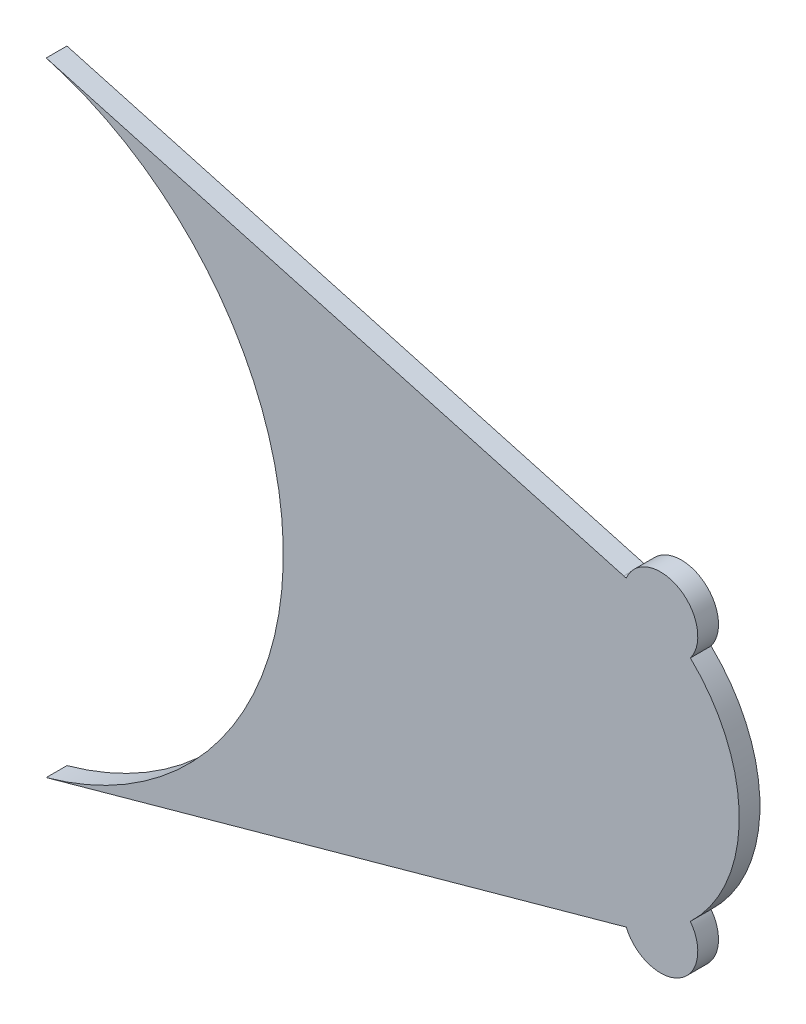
SolidWorks part; units mm, degrees
ref_plane "Plan de face" through (0, 0, 0) normal (0, 0, 1) x (1, 0, 0)
ref_plane "Plan de dessus" through (0, 0, 0) normal (0, 1, 0) x (1, 0, 0)
ref_plane "Plan de droite" through (0, 0, 0) normal (1, 0, 0) x (0, 0, -1)
sketch "Esquisse1" plane through (0, 0, 0) normal (0, 0, 1) x (1, 0, 0)
  line L0 (-64.3899, 0) -> (0, 0) construction
  line L1 (0, -55.9046) -> (0, 54.467) construction
  line L2 (75, -41.7813) -> (75, 24.8253) construction
  line L3 (10.4, 37.5878) -> (80.0667, 18.312)
  line L4 (10.4, -37.5878) -> (80.0667, -18.312)
  line L5 (75, 0) -> (91.9054, 29.281) construction
  line L6 (75, 0) -> (91.1299, -27.9378) construction
  line L7 (75, 0) -> (132.0405, 0) construction
  arc A1 (80.0667, -18.312) -> (80.3639, -18.2272) centre (75, 0) ccw
  arc A2 (88.1032, 13.7588) -> (80.3639, 18.2272) centre (84.5, 16.4545) ccw
  arc A3 (80.3639, -18.2272) -> (88.1032, -13.7588) centre (84.5, -16.4545) ccw
  arc A4 (80.3639, 18.2272) -> (80.0667, 18.312) centre (75, 0) ccw
  arc A5 (88.1032, -13.7588) -> (88.1032, 13.7588) centre (75, 0) ccw
  arc A6 (10.4, 37.5878) -> (10.4, -37.5878) centre (0, 0) cw
  dimension "D2" = 39
  dimension "D3" = 38
  dimension "D6" = 9
  dimension "D7" = 9
  dimension "D1" = 75
  dimension "D4" = 60
  dimension "D5" = 60
  dimension "D8" = 37.5878
  dimension "D9" = 37.5878
extrude "Extrusion1" add sketch "Esquisse1" along normal blind 2.5
